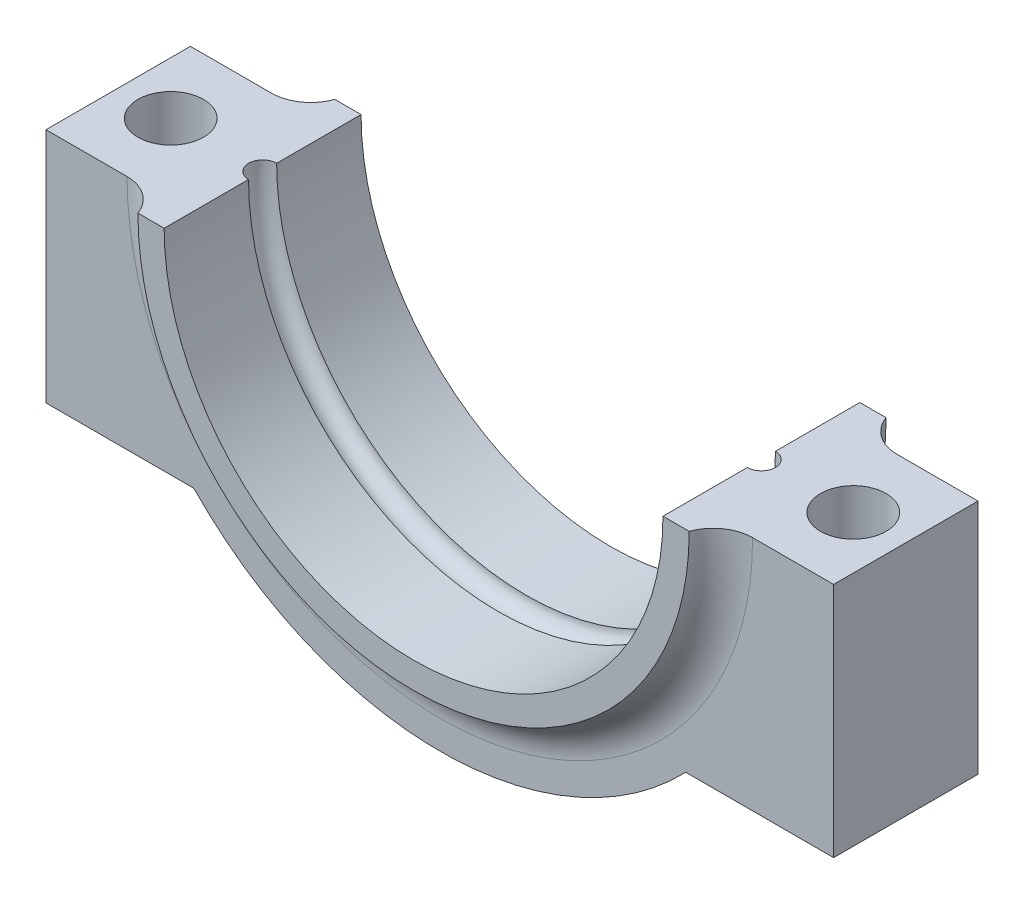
SolidWorks part; units mm, degrees
ref_plane "Front Plane" through (0, 0, 0) normal (0, 0, 1) x (1, 0, 0)
ref_plane "Top Plane" through (0, 0, 0) normal (0, 1, 0) x (1, 0, 0)
ref_plane "Right Plane" through (0, 0, 0) normal (1, 0, 0) x (0, 0, -1)
sketch "Sketch1" plane through (0, 0, 0) normal (0, 0, 1) x (1, 0, 0)
  line L0 (-30, 0) -> (-19, 0)
  line L1 (-30, -18.0278) -> (-30, 0)
  line L2 (19, 0) -> (30, 0)
  line L3 (30, -18.0278) -> (30, 0)
  line L4 (-30, -18.0278) -> (-18.735, -18.0278)
  line L5 (30, -18.0278) -> (18.735, -18.0278)
  arc A1 (-19, 0) -> (19, 0) centre (0, 0) ccw
  arc A2 (-18.735, -18.0278) -> (18.735, -18.0278) centre (0, 0) ccw
  dimension "D2" = 38
  dimension "D3" = 30
extrude "Boss-Extrude1" add sketch "Sketch1" along normal mid plane 11
sketch "Sketch2" plane through (0, 0, 5.5) normal (0, 0, 1) x (1, 0, 0)
  line L0 (-19, 0) -> (-21, 0)
  line L1 (19, 0) -> (21, 0)
  arc A0 (-21, 0) -> (21, 0) centre (0, 0) ccw
  arc A1 (-19, 0) -> (19, 0) centre (0, 0) ccw construction
  arc A2 (-19, 0) -> (19, 0) centre (0, 0) ccw
  dimension "D1" = 21
extrude "Boss-Extrude2" add sketch "Sketch2" along normal blind 2
sketch "Sketch3" plane through (0, 0, 0) normal (0, 1, 0) x (1, 0, 0)
  circle A0 centre (-26, 0) radius 2.5
  circle A1 centre (26, 0) radius 2.5
  dimension "D3" = 5
  dimension "D4" = 5
  dimension "D1" = 26
  dimension "D2" = 26
extrude "Cut-Extrude1" cut sketch "Sketch3" against normal blind 54
mirror "Mirror1" about plane through (0, 0, 0) normal (0, 0, 1) of "Boss-Extrude2"
fillet "Fillet1" radius 3 2 edges
sketch "Sketch4" plane through (0, 0, 0) normal (0, 1, 0) x (1, 0, 0)
  line L0 (-19, -7.5) -> (-19, 7.5) construction
  line L1 (0, 0.4522) -> (0, -10.1127) construction
  circle A0 centre (-19, 0) radius 1.07
revolve "Cut-Revolve1" cut sketch "Sketch4" angle 360 about L1
